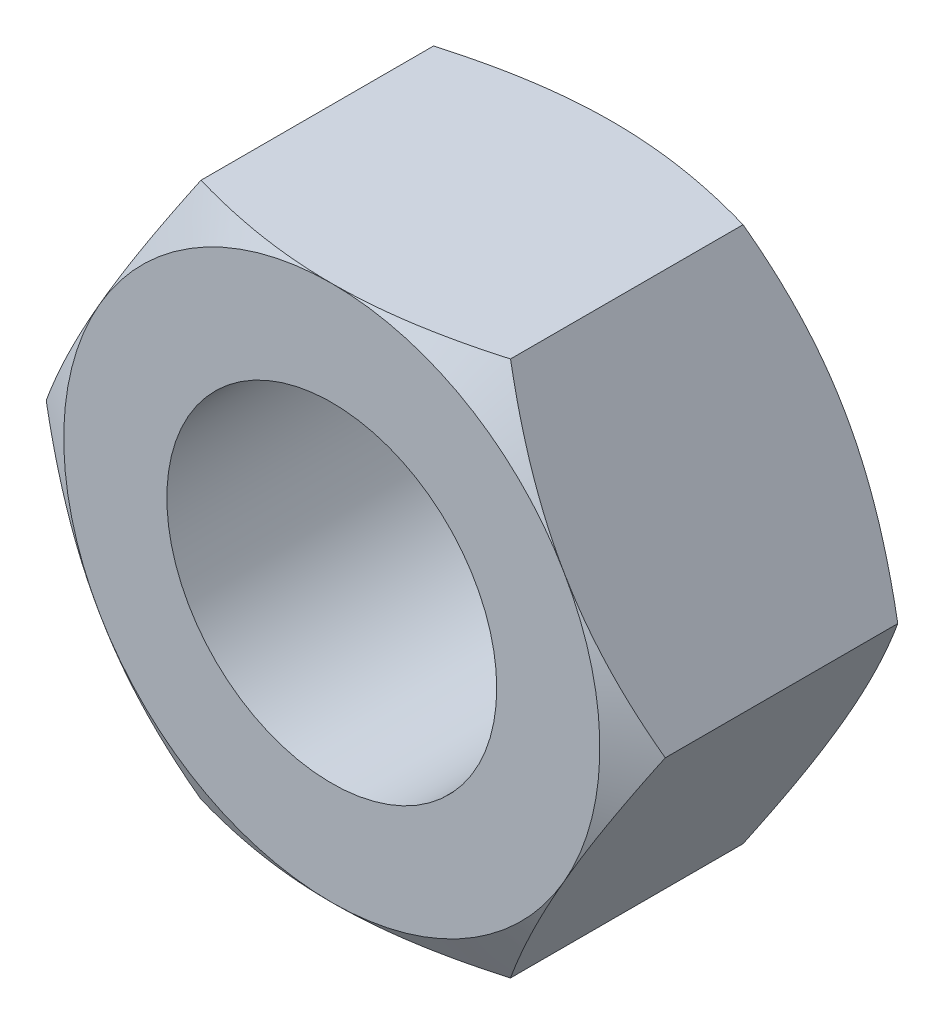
SolidWorks part; units mm, degrees
ref_plane "Plan1" through (0, 0, 0) normal (0, 0, 1) x (1, 0, 0)
ref_plane "Plan2" through (0, 0, 0) normal (0, 1, 0) x (1, 0, 0)
ref_plane "Plan3" through (0, 0, 0) normal (1, 0, 0) x (0, 0, -1)
sketch "Sketch1" plane through (0, 0, 0) normal (0, 0, 1) x (1, 0, 0)
  line L0 (-7.5056, 0) -> (7.5056, 0) construction
  line L1 (0, 6.5) -> (0, -6.5) construction
  line L2 (-3.7528, 6.5) -> (3.7528, 6.5)
  line L3 (3.7528, 6.5) -> (7.5056, 0)
  line L4 (7.5056, 0) -> (3.7528, -6.5)
  line L5 (3.7528, -6.5) -> (-3.7528, -6.5)
  line L6 (-3.7528, -6.5) -> (-7.5056, 0)
  line L7 (-7.5056, 0) -> (-3.7528, 6.5)
  dimension "D1" = 120
  dimension "S" = 13
extrude "Base-Extrude" add sketch "Sketch1" along normal blind 6.8
sketch "Sketch2" plane through (0, 0, 0) normal (0, 1, 0) x (1, 0, 0)
  line L0 (-6.5, 0) -> (-7.5056, 0)
  line L1 (0, 0) -> (0, -1.25) construction
  line L2 (-3.7528, 0) -> (-7.5056, 0) construction
  line L3 (-7.5056, 0) -> (-7.5056, -0.5806)
  line L4 (0, 0) -> (0, -6.8) construction
  line L5 (3.7528, 0) -> (-3.7528, 0) construction
  line L6 (3.7528, -6.8) -> (-3.7528, -6.8) construction
  line L7 (-6.5, 0) -> (-7.5056, -0.5806)
  line L8 (-7.5056, -6.8) -> (-7.5056, -6.2194)
  line L9 (-7.5056, -6.8) -> (-7.5056, 0) construction
  line L10 (-7.5056, -6.8) -> (-6.5, -6.8)
  line L11 (-3.7528, -6.8) -> (-7.5056, -6.8) construction
  line L12 (-6.5, -6.8) -> (-7.5056, -6.2194)
  dimension "D2" = 30
  dimension "P" = 1.25
revolve "Cut-Revolve1" cut sketch "Sketch2" angle 360 about L4
other "Hole1"
sketch "Sketch3" plane through (0, 0, 0) normal (0, 0, -1) x (-1, 0, 0)
  circle A0 centre (0, 0) radius 3.3234
  dimension "D1" = 6.6469
chamfer "Chamfer1" distance 0.6766 angle 45
sketch "Esquisse1" plane through (0, 0, 6.8) normal (0, 0, 1) x (1, 0, 0)
  circle A0 centre (0, 0) radius 4
  dimension "D1" = 8
extrude "DRW" cut sketch "Esquisse1" against normal through all
equation "\"D1@Sketch3\" = \"D@Cosmetic_Thread1\"-(1.0825*\"P@Sketch2\")"
equation "\"D1@Chamfer1\" = (\"D@Cosmetic_Thread1\"-\"D1@Sketch3\")/2"
